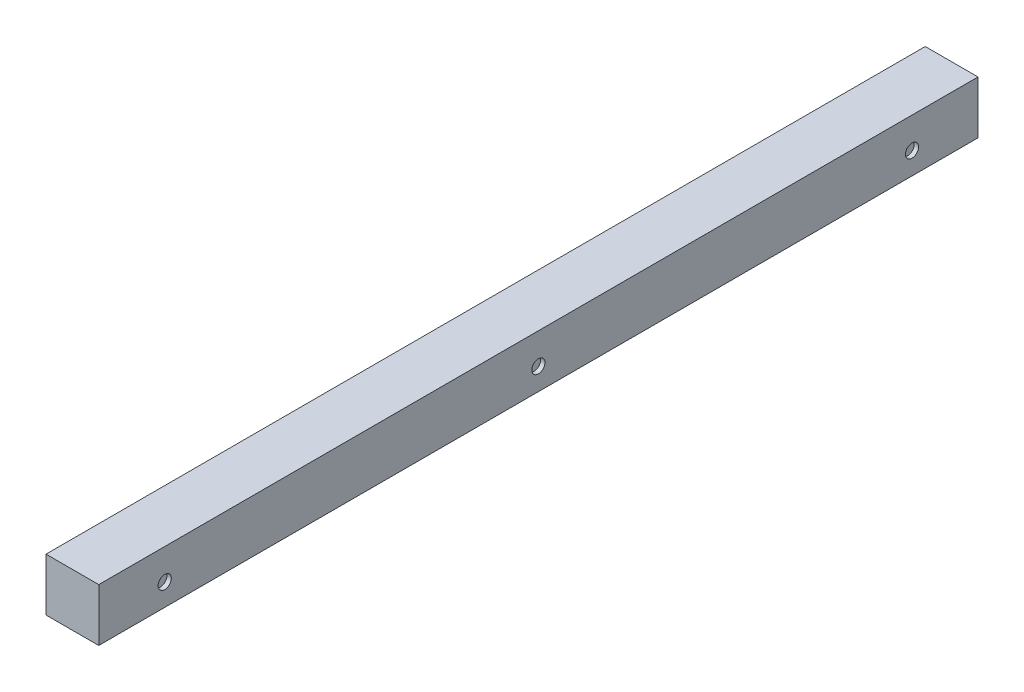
SolidWorks part; units mm, degrees
ref_plane "Plan de face" through (0, 0, 0) normal (0, 0, 1) x (1, 0, 0)
ref_plane "Plan de dessus" through (0, 0, 0) normal (0, 1, 0) x (1, 0, 0)
ref_plane "Plan de droite" through (0, 0, 0) normal (1, 0, 0) x (0, 0, -1)
sketch "Esquisse1" plane through (0, 0, 0) normal (0, 0, 1) x (1, 0, 0)
  line L0 (0, 38.5187) -> (0, -38.7834) construction
  line L1 (-58.9031, 0) -> (66.8451, 0) construction
  line L3 (-6, 6) -> (6, 6)
  line L4 (-6, 6) -> (-6, -6)
  line L5 (-6, -6) -> (6, -6)
  line L6 (6, 6) -> (6, -6)
  dimension "D1" = 12
  dimension "D2" = 12
extrude "Extrusion1" add sketch "Esquisse1" against normal blind 200
sketch "Esquisse3" plane through (6, 0, 0) normal (1, 0, 0) x (0, 0, -1)
  line L0 (0, -6) -> (0, 6) construction
  line L3 (200, -6) -> (0, -6) construction
  circle A0 centre (15, -1) radius 1.5
  dimension "D2" = 3
  dimension "D1" = 15
  dimension "D3" = 5
extrude "Enlèv. mat.-Extru.2" cut sketch "Esquisse3" against normal blind 1
pattern_linear "Répétition linéaire1" count 3 spacing 85 along (0, 0, -1) of "Enlèv. mat.-Extru.2"
